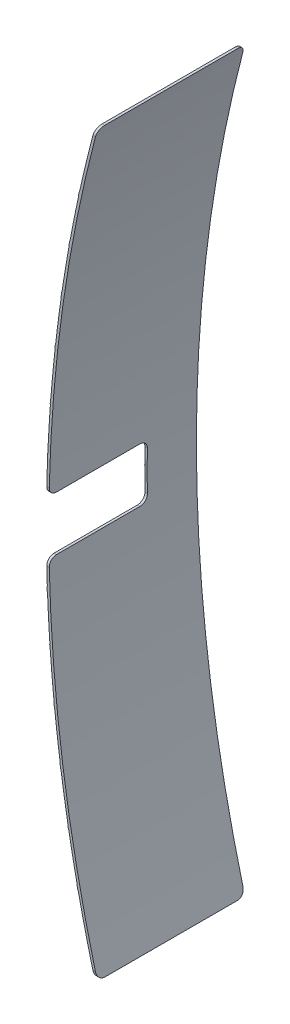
SolidWorks part; units mm, degrees
ref_plane "前视基准面" through (0, 0, 0) normal (0, 0, 1) x (1, 0, 0)
ref_plane "上视基准面" through (0, 0, 0) normal (0, 1, 0) x (1, 0, 0)
ref_plane "右视基准面" through (0, 0, 0) normal (1, 0, 0) x (0, 0, -1)
sketch "草图1" plane through (0, 0, 0) normal (0, 0, 1) x (1, 0, 0)
  line L0 (-56.1303, 15) -> (-56.0268, 15)
  line L1 (-56.1303, -15) -> (-56.0268, -15)
  line L2 (-1000, 0) -> (49000, 0) construction
  arc A0 (-56.1303, 15) -> (-56.1303, -15) centre (0, 0) ccw
  arc A1 (-56.0268, 15) -> (-56.0268, -15) centre (0, 0) ccw
  dimension "D1" = 116.2
  dimension "D2" = 116
  dimension "D3" = 30
extrude "凸台-拉伸1" add sketch "草图1" along normal blind 6
ref_plane "基准面1" through (-50, 0, 0) normal (1, 0, 0) x (0, 0, -1)
sketch "草图4" plane through (0, 0, 0) normal (1, 0, 0) x (0, 0, -1)
  line L0 (-6, -1.1) -> (-2, -1.1)
  line L1 (-6, 15) -> (-6, -15) construction
  line L2 (-2, -1.1) -> (-2, 1.1)
  line L3 (-2, 1.1) -> (-6, 1.1)
  line L4 (-6, 1.1) -> (-6, -1.1)
  line L5 (-1000, 0) -> (49000, 0) construction
  dimension "D1" = 4
  dimension "D2" = 2.2
extrude "切除-拉伸1" cut sketch "草图4" against normal through all
fillet "圆角1" radius 0.3 8 edges at (-56.0785, -15, 6) (-56.0785, -15, 0) (-56.0785, 15, 6) (-56.0785, 15, 0) (-58.0396, -1.1, 2) (-58.0396, 1.1, 2) (-58.0396, 1.1, 6) (-58.0396, -1.1, 6)
sketch "草图5" plane through (-50, 0, 0) normal (1, 0, 0) x (0, 0, -1)
  line L0 (0, -2.8572) -> (0, 3.1428)
  line L1 (0, 3.1428) -> (-2, 0.1428)
  line L2 (-2, 0.1428) -> (0, -2.8572)
  line L3 (-1002, 0.1428) -> (48998, 0.1428) construction
  line L4 (0, -14.7) -> (0, 14.7) construction
  line L5 (-2, 0.8) -> (-2, -0.8) construction
  line L6 (-6, -1.4) -> (-6, -14.7) construction
  line L7 (-6, -2.3) -> (-2, -2.3)
  line L8 (-6, -2.3) -> (-6, -2.1)
  line L9 (-6, -2.1) -> (-2, -2.1)
  line L10 (-2, -2.3) -> (-2, -2.1)
  line L11 (-6, -4.3) -> (-2, -4.3)
  line L12 (-6, -4.3) -> (-6, -4.1)
  line L13 (-6, -4.1) -> (-2, -4.1)
  line L14 (-2, -4.3) -> (-2, -4.1)
  line L15 (-6, -6.3) -> (-2, -6.3)
  line L16 (-6, -6.3) -> (-6, -6.1)
  line L17 (-6, -6.1) -> (-2, -6.1)
  line L18 (-2, -6.3) -> (-2, -6.1)
  line L19 (-6, -8.3) -> (-2, -8.3)
  line L20 (-6, -8.3) -> (-6, -8.1)
  line L21 (-6, -8.1) -> (-2, -8.1)
  line L22 (-2, -8.3) -> (-2, -8.1)
  line L23 (-6, -10.3) -> (-2, -10.3)
  line L24 (-6, -10.3) -> (-6, -10.1)
  line L25 (-6, -10.1) -> (-2, -10.1)
  line L26 (-2, -10.3) -> (-2, -10.1)
  line L27 (-6, -12.3) -> (-2, -12.3)
  line L28 (-6, -12.3) -> (-6, -12.1)
  line L29 (-6, -12.1) -> (-2, -12.1)
  line L30 (-2, -12.3) -> (-2, -12.1)
  line L31 (-5.7, -1.1) -> (-2.3, -1.1) construction
  line L32 (-2, 12.5855) -> (-2, 12.3855)
  line L33 (-6, 12.3855) -> (-2, 12.3855)
  line L34 (-6, 12.5855) -> (-6, 12.3855)
  line L35 (-6, 12.5855) -> (-2, 12.5855)
  line L36 (-2, 10.5855) -> (-2, 10.3855)
  line L37 (-6, 10.3855) -> (-2, 10.3855)
  line L38 (-6, 10.5855) -> (-6, 10.3855)
  line L39 (-6, 10.5855) -> (-2, 10.5855)
  line L40 (-2, 8.5855) -> (-2, 8.3855)
  line L41 (-6, 8.3855) -> (-2, 8.3855)
  line L42 (-6, 8.5855) -> (-6, 8.3855)
  line L43 (-6, 8.5855) -> (-2, 8.5855)
  line L44 (-2, 6.5855) -> (-2, 6.3855)
  line L45 (-6, 6.3855) -> (-2, 6.3855)
  line L46 (-6, 6.5855) -> (-6, 6.3855)
  line L47 (-6, 6.5855) -> (-2, 6.5855)
  line L48 (-2, 4.5855) -> (-2, 4.3855)
  line L49 (-6, 4.3855) -> (-2, 4.3855)
  line L50 (-6, 4.5855) -> (-6, 4.3855)
  line L51 (-6, 4.5855) -> (-2, 4.5855)
  line L52 (-2, 2.5855) -> (-2, 2.3855)
  line L53 (-6, 2.3855) -> (-2, 2.3855)
  line L54 (-6, 2.5855) -> (-6, 2.3855)
  line L55 (-6, 2.5855) -> (-2, 2.5855)
  dimension "D1" = 6
  dimension "D2" = 0.2
  dimension "D3" = 4
  dimension "D5" = 1
  dimension "D4" = 6
wrap "包覆1" sketch "草图5" wrap type emboss source sketch "草图5" thickness 0.01 parameters "D1"=0.01
